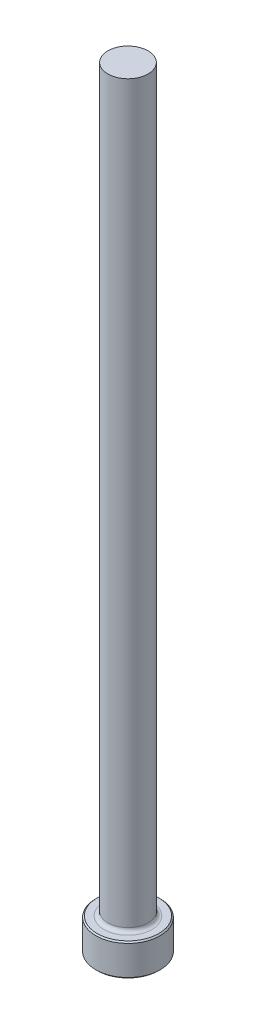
SolidWorks part; units mm, degrees
ref_plane "Front Plane" through (0, 0, 0) normal (0, 0, 1) x (1, 0, 0)
ref_plane "Top Plane" through (0, 0, 0) normal (0, 1, 0) x (1, 0, 0)
ref_plane "Right Plane" through (0, 0, 0) normal (1, 0, 0) x (0, 0, -1)
sketch "Sketch1" plane through (0, 0, 0) normal (0, 0, 1) x (1, 0, 0)
  line L0 (0, 259.9588) -> (0, -15.1925) construction
  line L1 (0, 0) -> (-6.35, 0)
  line L2 (-6.35, 0) -> (-6.35, 6.35)
  line L3 (-6.35, 6.35) -> (-3.9687, 6.35)
  line L4 (-3.9687, 6.35) -> (-3.9687, 152.4)
  line L5 (-3.9687, 152.4) -> (0, 152.4)
  line L6 (0, 152.4) -> (0, 0)
  dimension "L" = 152.4
  dimension "H" = 12.7
  dimension "T" = 6.35
  dimension "D" = 7.9375
revolve "Revolve1" add sketch "Sketch1" angle 360 about L0
chamfer "Chamfer1" distance 0.254 angle 45 2 edges at (0, 6.35, 6.35) (0, 0, 6.35)
fillet "Fillet1" radius 0.762 1 edges at (0, 6.35, 3.9687)
sketch "Pocket Sketch" plane through (0, 0, 0) normal (0, 0, 1) x (1, 0, 0)
  line L0 (-6.7469, 0) -> (-6.7469, 6.3754)
  line L1 (-6.7469, 6.3754) -> (-5.1276, 6.3754)
  line L2 (-4.3656, 7.1374) -> (-4.3656, 22.225)
  line L3 (-4.3656, 22.225) -> (0, 22.225)
  line L4 (0, 22.225) -> (0, 0)
  line L5 (0, 0) -> (-6.7469, 0)
  line L6 (0, 12.6104) -> (0, -2.4989) construction
  line L7 (-6.35, 6.096) -> (-6.35, 0.254) construction
  line L8 (6.096, 6.35) -> (-6.096, 6.35) construction
  line L9 (-3.9687, 152.4) -> (-3.9687, 7.112) construction
  line L10 (-5.1276, 6.3754) -> (-4.3656, 7.1374)
  point P3 (-4.3656, 6.3754)
  dimension "D1" = 13.4937
  dimension "D2" = 0.3969
  dimension "D3" = 0.0254
  dimension "D4" = 0.3969
  dimension "D5" = 8.7312
  dimension "D6" = 22.225
